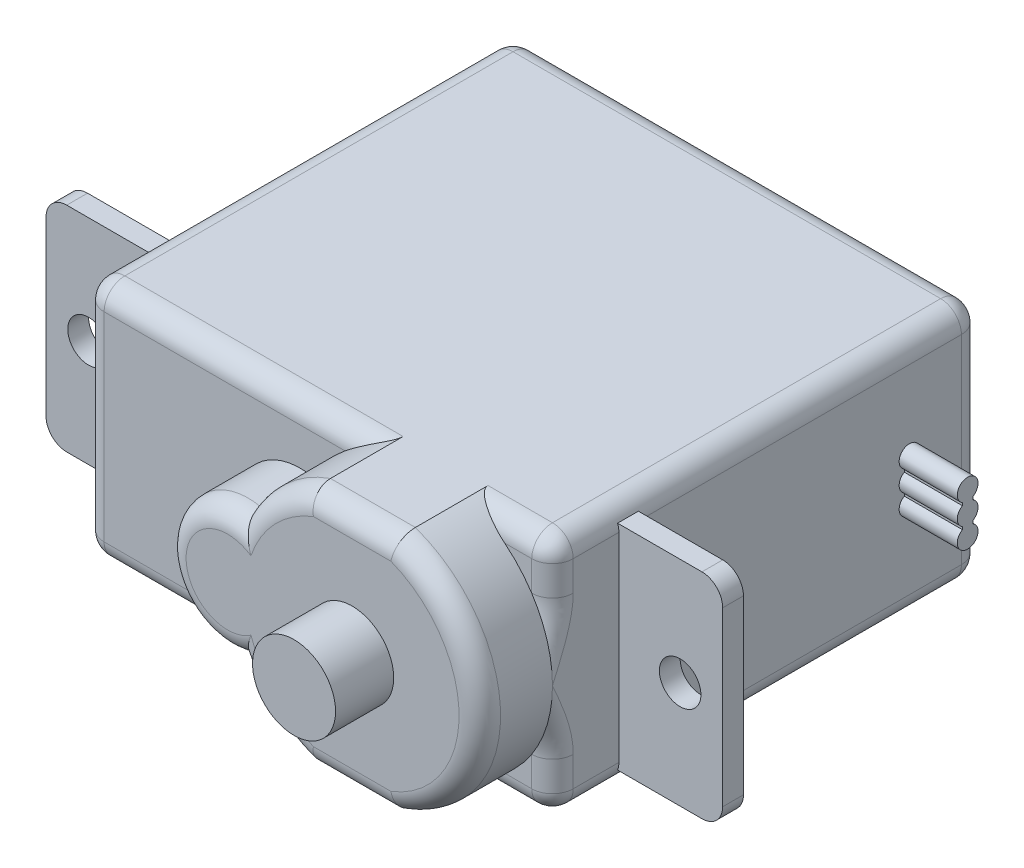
SolidWorks part; units mm, degrees
ref_plane "Front Plane" through (0, 0, 0) normal (0, 0, 1) x (1, 0, 0)
ref_plane "Top Plane" through (0, 0, 0) normal (0, 1, 0) x (1, 0, 0)
ref_plane "Right Plane" through (0, 0, 0) normal (1, 0, 0) x (0, 0, -1)
sketch "Sketch1" plane through (0, 0, 0) normal (0, 1, 0) x (1, 0, 0)
  line L0 (0, 0) -> (22.6, 0)
  line L1 (22.6, 0) -> (22.6, 20.7)
  line L2 (22.6, 20.7) -> (0, 20.7)
  line L3 (0, 20.7) -> (0, 0)
  dimension "D1" = 20.7
  dimension "D2" = 22.6
extrude "Boss-Extrude1" add sketch "Sketch1" along normal blind 11.6
ref_plane "Plane1" through (0, 0, -3.2) normal (0, 0, 1) x (1, 0, 0)
sketch "Sketch3" plane through (0, 0, -3.2) normal (0, 0, 1) x (1, 0, 0)
  line L0 (22.6, 10.95) -> (27.6, 10.95)
  line L1 (22.6, 11.6) -> (22.6, 0) construction
  line L2 (27.6, 10.95) -> (27.6, 0.65)
  line L3 (27.6, 0.65) -> (22.6, 0.65)
  line L4 (22.6, 0.65) -> (22.6, 10.95)
  line L5 (0, 10.95) -> (-5, 10.95)
  line L6 (-5, 10.95) -> (-5, 0.65)
  line L7 (-5, 0.65) -> (0, 0.65)
  line L8 (0, 11.6) -> (0, 0) construction
  line L9 (0, 0.65) -> (0, 10.95)
  line L10 (0, 5.8) -> (22.6, 5.8) construction
  line L11 (11.3, 11.6) -> (11.3, 0) construction
  line L12 (0, 11.6) -> (22.6, 11.6) construction
  line L13 (0, 0) -> (22.6, 0) construction
  line L14 (-5, 5.8) -> (-2.95, 5.8) construction
  line L15 (27.6, 5.8) -> (25.55, 5.8) construction
  circle A0 centre (-2.95, 5.8) radius 1
  circle A1 centre (25.55, 5.8) radius 1
  point P20 (11.3, 5.8)
  dimension "D3" = 28.5
  dimension "D4" = 2
  dimension "D1" = 5
  dimension "D2" = 10.3
extrude "Boss-Extrude2" add sketch "Sketch3" against normal blind 1
sketch "Sketch4" plane through (0, 0, 0) normal (0, 0, 1) x (1, 0, 0)
  line L0 (0, 5.8) -> (22.6, 5.8) construction
  line L1 (0, 0.65) -> (0, 10.95) construction
  line L2 (22.6, 10.95) -> (22.6, 0.65) construction
  line L3 (18.4951, 11.6) -> (14.4049, 11.6)
  line L4 (0, 11.6) -> (22.6, 11.6) construction
  line L5 (18.4951, 0) -> (14.4049, 0)
  line L6 (0, 0) -> (22.6, 0) construction
  arc A0 (18.4951, 0) -> (18.4951, 11.6) centre (16.45, 5.8) ccw
  arc A1 (14.4049, 11.6) -> (11.0481, 8.7398) centre (16.45, 5.8) ccw
  arc A2 (11.0481, 8.7398) -> (11.0481, 2.8602) centre (10.45, 5.8) ccw
  arc A3 (11.0481, 2.8602) -> (14.4049, 0) centre (16.45, 5.8) ccw
  dimension "D1" = 12.3
  dimension "D2" = 6
  dimension "D3" = 6
extrude "Boss-Extrude3" add sketch "Sketch4" along normal blind 3.5
sketch "Sketch5" plane through (0, 0, 3.5) normal (0, 0, 1) x (1, 0, 0)
  circle A0 centre (16.45, 5.8) radius 2
  dimension "D1" = 4
extrude "Boss-Extrude4" add sketch "Sketch5" along normal blind 2.8
sketch "Sketch6" plane through (22.6, 0, 0) normal (1, 0, 0) x (0, 0, -1)
  line L0 (0, 5.8) -> (20.7, 5.8) construction
  line L1 (20.7, 11.6) -> (20.7, 0) construction
  line L2 (16.95, 6.8) -> (16.95, 4.8)
  line L3 (16.95, 4.8) -> (17.45, 4.8)
  line L4 (17.45, 4.8) -> (17.45, 6.8)
  line L5 (17.45, 6.8) -> (16.95, 6.8)
  circle A0 centre (17.2, 5.8) radius 0.5
  circle A1 centre (17.2, 6.8) radius 0.5
  circle A2 centre (17.2, 4.8) radius 0.5
  dimension "D1" = 1
  dimension "D2" = 3.5
  dimension "D3" = 0.5
extrude "Boss-Extrude7" add sketch "Sketch6" along normal blind 2.8 contours A1 | L2 L3 L4 L5 | A0 | A2
fillet "Fillet1" radius 1 25 edges at (22.6, 8.7, 0) (12.4613, 1.1189, 3.5) (12.4613, 10.4811, 3.5) (22.6, 5.8, 3.5) (16.45, 0, 3.5) (16.45, 11.6, 3.5) (7.45, 5.8, 3.5) (-5, 0.65, -3.7) (-5, 10.95, -3.7) (0, 5.8, -20.7) (22.6, 5.8, -20.7) (11.3, 0, -20.7) (0, 0, -10.35) (0, 5.8, 0) (22.6, 2.9, 0) (22.6, 0, -10.35) (27.6, 0.65, -3.7) (27.6, 10.95, -3.7) (22.6, 11.6, -10.35) (11.3, 11.6, -20.7) (0, 11.6, -10.35)
